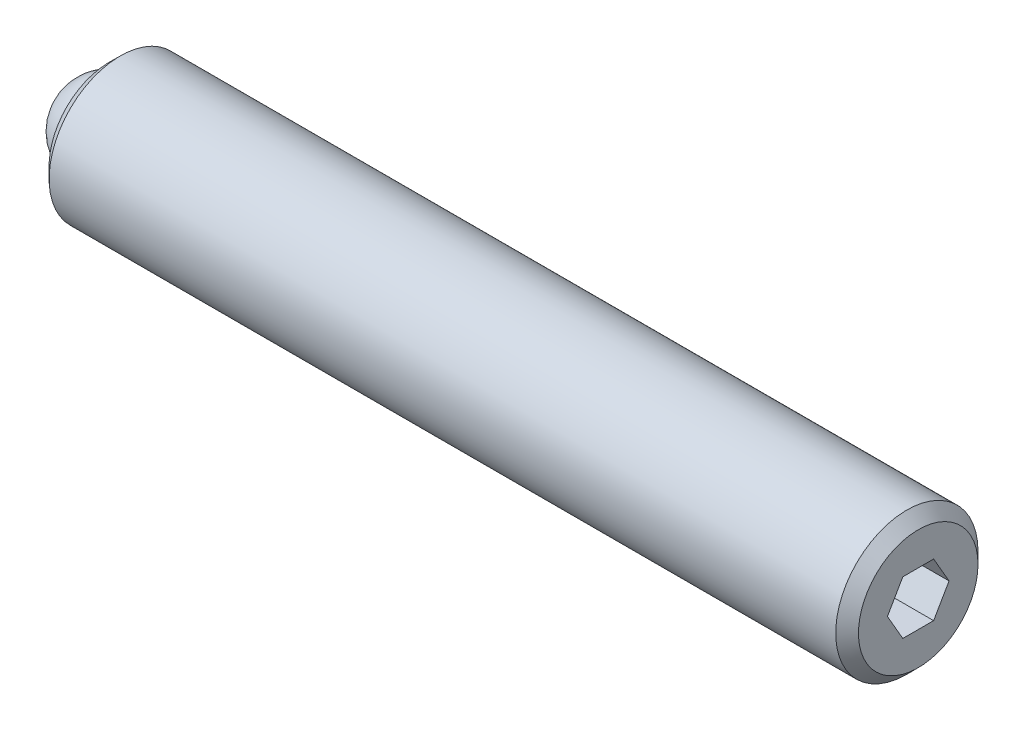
SolidWorks part; units mm, degrees
ref_plane "Front Plane" through (0, 0, 0) normal (0, 0, 1) x (1, 0, 0)
ref_plane "Top Plane" through (0, 0, 0) normal (0, 1, 0) x (1, 0, 0)
ref_plane "Right Plane" through (0, 0, 0) normal (1, 0, 0) x (0, 0, -1)
sketch "Sketch2" plane through (0, 0, 0) normal (1, 0, 0) x (0, 0, -1)
  circle A0 centre (0, 0) radius 3.175
  dimension "D1" = 6.35
extrude "Boss-Extrude1" add sketch "Sketch2" along normal blind 36.1156
sketch "Sketch3" plane through (0, 0, 0) normal (-1, 0, 0) x (0, 0, 1)
  circle A0 centre (0, 0) radius 1.9812
  dimension "D1" = 3.9624
chamfer "Chamfer1" distance 0.508 angle 45 1 edges at (0, 0, -3.175)
chamfer "Chamfer2" distance 0.508 angle 45 1 edges at (36.1156, 0, -3.175)
sketch "Sketch4" plane through (36.1156, 0, 0) normal (1, 0, 0) x (0, 0, -1)
  line L1 (1.3748, 0) -> (0.6874, 1.1906)
  line L2 (0.6874, 1.1906) -> (-0.6874, 1.1906)
  line L3 (-0.6874, 1.1906) -> (-1.3748, 0)
  line L4 (-1.3748, 0) -> (-0.6874, -1.1906)
  line L5 (-0.6874, -1.1906) -> (0.6874, -1.1906)
  line L6 (0.6874, -1.1906) -> (1.3748, 0)
  circle A0 centre (0, 0) radius 1.1906 construction
  dimension "D1" = 2.3813
extrude "Cut-Extrude2" cut sketch "Sketch4" against normal blind 2.286
extrude "Cut-Extrude3" cut sketch "Sketch3" against normal blind 1.9844
sketch "Sketch5" plane through (0, 0, 0) normal (-1, 0, 0) x (0, 0, 1)
  line L0 (0, 0) -> (0, -1.9844)
  line L1 (0, 0) -> (0, 1.9844)
  arc A0 (0, 1.9844) -> (0, -1.9844) centre (0, 0) ccw
  dimension "D1" = 1.9844
revolve "Revolve1" add sketch "Sketch5" angle 360 about L1
